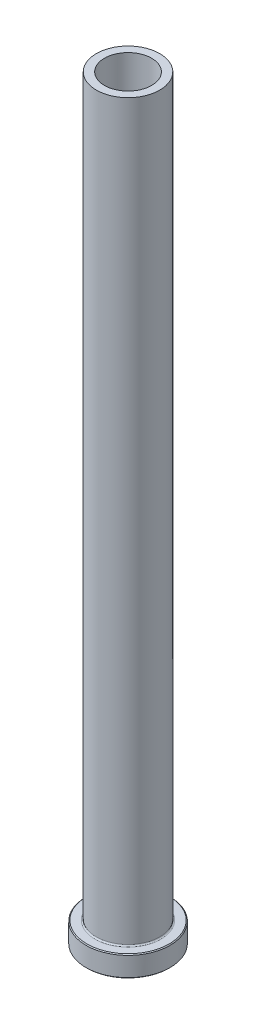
SolidWorks part; units mm, degrees
ref_plane "Front Plane" through (0, 0, 0) normal (0, 0, 1) x (1, 0, 0)
ref_plane "Top Plane" through (0, 0, 0) normal (0, 1, 0) x (1, 0, 0)
ref_plane "Right Plane" through (0, 0, 0) normal (1, 0, 0) x (0, 0, -1)
sketch "Sketch1" plane through (0, 0, 0) normal (0, 0, 1) x (1, 0, 0)
  line L0 (0, 0) -> (0, 50000) construction
  line L1 (0, 0) -> (12.7, 0)
  line L2 (12.7, 0) -> (12.7, 6.35)
  line L3 (12.7, 6.35) -> (9.979, 6.35)
  line L4 (9.5822, 6.7469) -> (9.5822, 228.6)
  line L5 (9.5822, 228.6) -> (0, 228.6)
  line L6 (0, 228.6) -> (0, 0)
  arc A0 (9.5822, 6.7469) -> (9.979, 6.35) centre (9.979, 6.7469) ccw
  dimension "D5" = 0.3969
  dimension "D1" = 19.1643
  dimension "D2" = 25.4
  dimension "D3" = 6.35
  dimension "D4" = 228.6
revolve "Revolve1" add sketch "Sketch1" angle 360 about L0
sketch "Sketch2" plane through (0, 0, 0) normal (0, 0, 1) x (1, 0, 0)
  line L0 (0, 0) -> (0, 50000) construction
  line L1 (-12.7, 0) -> (12.7, 0) construction
  line L2 (8.5249, 0) -> (8.128, 0.3969)
  line L3 (8.128, 0.3969) -> (8.128, 154.1145)
  line L4 (8.128, 154.1145) -> (7.1437, 168.402)
  line L5 (7.1437, 168.402) -> (7.1437, 228.6)
  line L6 (9.5822, 228.6) -> (-9.5822, 228.6) construction
  line L7 (7.1437, 228.6) -> (0, 228.6)
  line L8 (0, 228.6) -> (0, 0)
  line L9 (0, 0) -> (8.5249, 0)
  point P4 (0, 0)
  dimension "D1" = 0.3969
  dimension "D2" = 45
  dimension "D3" = 14.2875
  dimension "D4" = 16.256
  dimension "D5" = 60.198
  dimension "D6" = 14.2875
revolve "Cut-Revolve1" cut sketch "Sketch2" angle 360 about L0
chamfer "Chamfer1" distance 0.254 angle 45 2 edges at (0, 0, -12.7) (0, 6.35, -12.7)
